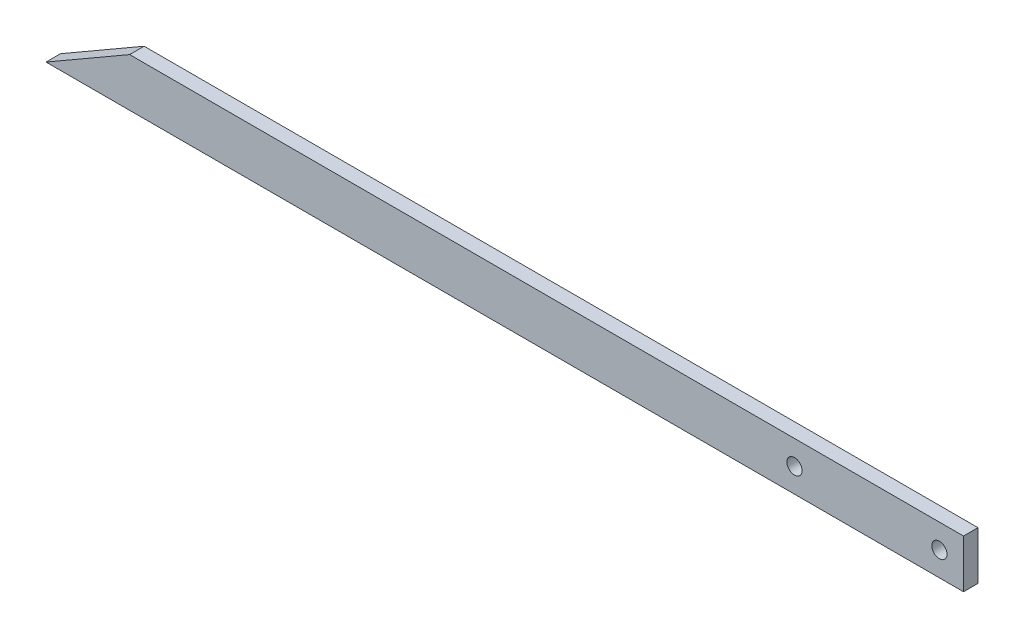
SolidWorks part; units mm, degrees
ref_plane "Front Plane" through (0, 0, 0) normal (0, 0, 1) x (1, 0, 0)
ref_plane "Top Plane" through (0, 0, 0) normal (0, 1, 0) x (1, 0, 0)
ref_plane "Right Plane" through (0, 0, 0) normal (1, 0, 0) x (0, 0, -1)
sketch "Sketch3" plane through (0, 0, 0) normal (0, 0, 1) x (1, 0, 0)
  line L0 (0, 0) -> (43.9941, 25.4)
  line L1 (0, 0) -> (482.6, 0)
  line L2 (0, 0) -> (0, 25.4) construction
  line L3 (0, 25.4) -> (482.6, 25.4) construction
  line L4 (482.6, 0) -> (482.6, 25.4)
  line L5 (43.9941, 25.4) -> (482.6, 25.4)
  dimension "D1" = 25.4
  dimension "D2" = 482.6
  dimension "D3" = 60
extrude "Boss-Extrude1" add sketch "Sketch3" along normal blind 7.62
sketch "Sketch4" plane through (0, 0, 7.62) normal (0, 0, 1) x (1, 0, 0)
  line L0 (482.6, 12.7) -> (-78.1806, 12.7) construction
  line L1 (482.6, 0) -> (482.6, 25.4) construction
  line L2 (469.9, 35.7814) -> (469.9, -17.994) construction
  line L3 (393.7, 35.7814) -> (393.7, -19.7623) construction
  circle A0 centre (469.9, 12.7) radius 4
  circle A1 centre (393.7, 12.7) radius 4
  dimension "D2" = 8
  dimension "D1" = 12.7
  dimension "D3" = 76.2
extrude "Cut-Extrude1" cut sketch "Sketch4" against normal through all
